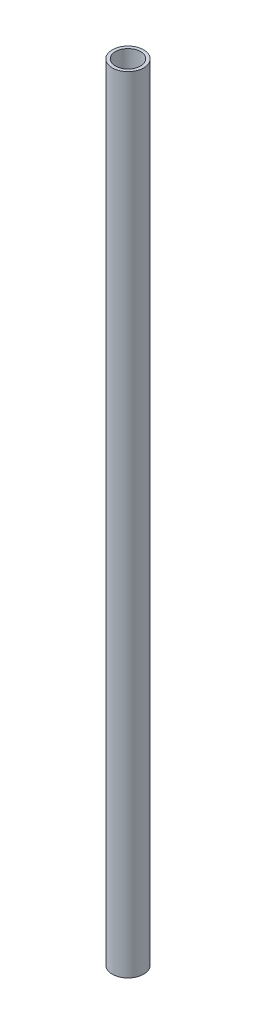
SolidWorks part; units mm, degrees
ref_plane "Front Plane" through (0, 0, 0) normal (0, 0, 1) x (1, 0, 0)
ref_plane "Top Plane" through (0, 0, 0) normal (0, 1, 0) x (1, 0, 0)
ref_plane "Right Plane" through (0, 0, 0) normal (1, 0, 0) x (0, 0, -1)
sketch "Sketch1" plane through (0, 0, 0) normal (0, 1, 0) x (1, 0, 0)
  circle A0 centre (0, 0) radius 5
  circle A1 centre (0, 0) radius 4
  dimension "D1" = 8
  dimension "D2" = 10
extrude "Boss-Extrude1" add sketch "Sketch1" along normal blind 250
